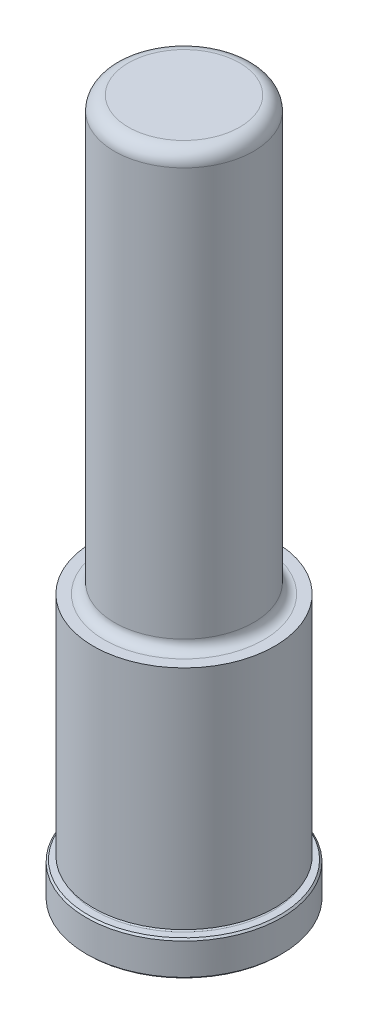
SolidWorks part; units mm, degrees
ref_plane "Front Plane" through (0, 0, 0) normal (0, 0, 1) x (1, 0, 0)
ref_plane "Top Plane" through (0, 0, 0) normal (0, 1, 0) x (1, 0, 0)
ref_plane "Right Plane" through (0, 0, 0) normal (1, 0, 0) x (0, 0, -1)
sketch "Sketch1" plane through (0, 0, 0) normal (1, 0, 0) x (0, 0, -1)
  line L0 (0, 0) -> (22.225, 0)
  line L1 (22.225, 0) -> (22.225, 7.9248)
  line L2 (22.225, 7.9248) -> (20.2438, 7.9248)
  line L3 (19.8628, 2.6782) -> (19.8628, 5.9795) construction
  line L4 (20.2438, 8.6868) -> (20.6502, 8.6868)
  line L5 (20.6502, 8.6868) -> (20.6502, 60.325)
  line L6 (20.6502, 60.325) -> (18.1483, 60.325)
  line L7 (15.8623, 62.611) -> (15.8623, 158.75)
  line L9 (15.8623, 158.75) -> (0, 158.75)
  line L10 (0, 158.75) -> (0, 0)
  line L11 (0, 0) -> (0, -7.2694) construction
  arc A0 (20.2438, 8.6868) -> (20.2438, 7.9248) centre (20.2438, 8.3058) ccw
  arc A1 (18.1483, 60.325) -> (15.8623, 62.611) centre (18.1483, 62.611) cw
  point P2 (15.8623, 158.75)
  point P14 (15.8623, 158.4586)
  point P19 (15.8623, 60.325)
  dimension "D14" = 0.762
  dimension "D8" = 2.286
  dimension "T" = 7.9248
  dimension "D2" = 0.762
  dimension "M" = 44.45
  dimension "B" = 41.3004
  dimension "L" = 158.75
  dimension "D7" = 0.7874
  dimension "A" = 60.325
  dimension "D" = 31.7246
  dimension "D15" = 98.425
revolve "Revolve1" add sketch "Sketch1" angle 360 about L11
chamfer "Chamfer1" distance 0.381 angle 45 2 edges at (0, 0, 22.225) (0, 7.9248, 22.225)
fillet "Fillet7" radius 3.175 1 edges at (0, 158.75, 15.8623)
